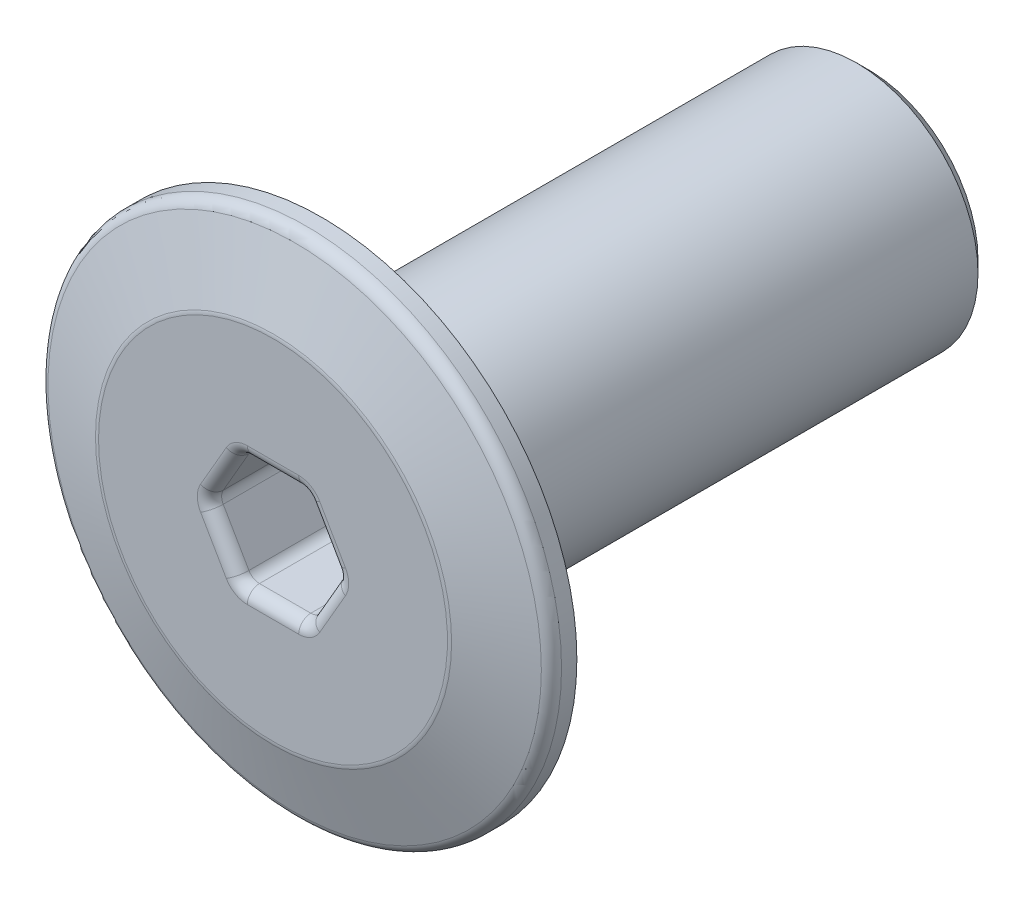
SolidWorks part; units mm, degrees
ref_plane "Plan de face" through (0, 0, 0) normal (0, 0, 1) x (1, 0, 0)
ref_plane "Plan de dessus" through (0, 0, 0) normal (0, 1, 0) x (1, 0, 0)
ref_plane "Plan de droite" through (0, 0, 0) normal (1, 0, 0) x (0, 0, -1)
sketch "Esquisse1" plane through (0, 0, 0) normal (1, 0, 0) x (0, 0, -1)
  line L0 (0, 0) -> (20.3846, 0) construction
  line L1 (23.5128, 0) -> (23.5128, 5)
  line L2 (23.5128, 5) -> (1.5128, 5)
  line L3 (1.0128, 6) -> (1.0128, 10.5)
  line L4 (1.0128, 10.5) -> (0.0128, 10.5)
  line L5 (0.0128, 10.5) -> (-0.9872, 7.2521)
  line L6 (-0.9872, 7.2521) -> (-0.9872, 0)
  line L7 (1.0128, 6) -> (1.5128, 6)
  line L8 (1.5128, 6) -> (1.5128, 5)
  line L9 (23.5128, 0) -> (-0.9872, 0)
  dimension "D1" = 5
  dimension "D2" = 0.5
  dimension "D3" = 22
  dimension "D4" = 1
  dimension "D5" = 1
  dimension "D6" = 1
  dimension "D7" = 10.5
revolve "Révolution1" add sketch "Esquisse1" angle 360 about L0
chamfer "Chanfrein1" distance 0.5 angle 45 1 edges at (5, 0, -23.5128)
sketch "Esquisse2" plane through (0, 0, 0.9872) normal (0, 0, 1) x (1, 0, 0)
  line L6 (-2.6906, 0) -> (-1.3453, 2.3301)
  line L7 (-1.3453, 2.3301) -> (1.3453, 2.3301)
  line L8 (1.3453, 2.3301) -> (2.6906, 0)
  line L9 (2.6906, 0) -> (1.3453, -2.3301)
  line L10 (1.3453, -2.3301) -> (-1.3453, -2.3301)
  line L11 (-1.3453, -2.3301) -> (-2.6906, 0)
extrude "Enlèv. mat.-Extru.2" cut sketch "Esquisse2" against normal blind 5
fillet "Congé2" radius 0.5 6 edges at (-2.0179, -1.1651, -4.0128) (-2.0179, 1.1651, -4.0128) (0, 2.3301, -4.0128) (2.0179, 1.1651, -4.0128) (2.0179, -1.1651, -4.0128) (0, -2.3301, -4.0128)
fillet "Congé3" radius 0.5 20 edges at (-2.0179, -1.1651, 0.9872) (0, -2.3301, 0.9872) (2.0179, -1.1651, 0.9872) (2.0179, 1.1651, 0.9872) (0, 2.3301, 0.9872) (-2.0179, 1.1651, 0.9872) (-1.3453, 2.3301, -1.2628) (1.3453, 2.3301, -1.2628) (-2.6906, 0, -1.2628) (-1.3453, -2.3301, -1.2628) (1.3453, -2.3301, -1.2628) (2.6906, 0, -1.2628) (-1.2607, 2.1837, -3.8664) (-2.5215, 0, -3.8664) (-1.2607, -2.1837, -3.8664) (1.2607, -2.1837, -3.8664) (2.5215, 0, -3.8664) (1.2607, 2.1837, -3.8664) (7.2521, 0, 0.9872) (10.5, 0, -0.0128)
